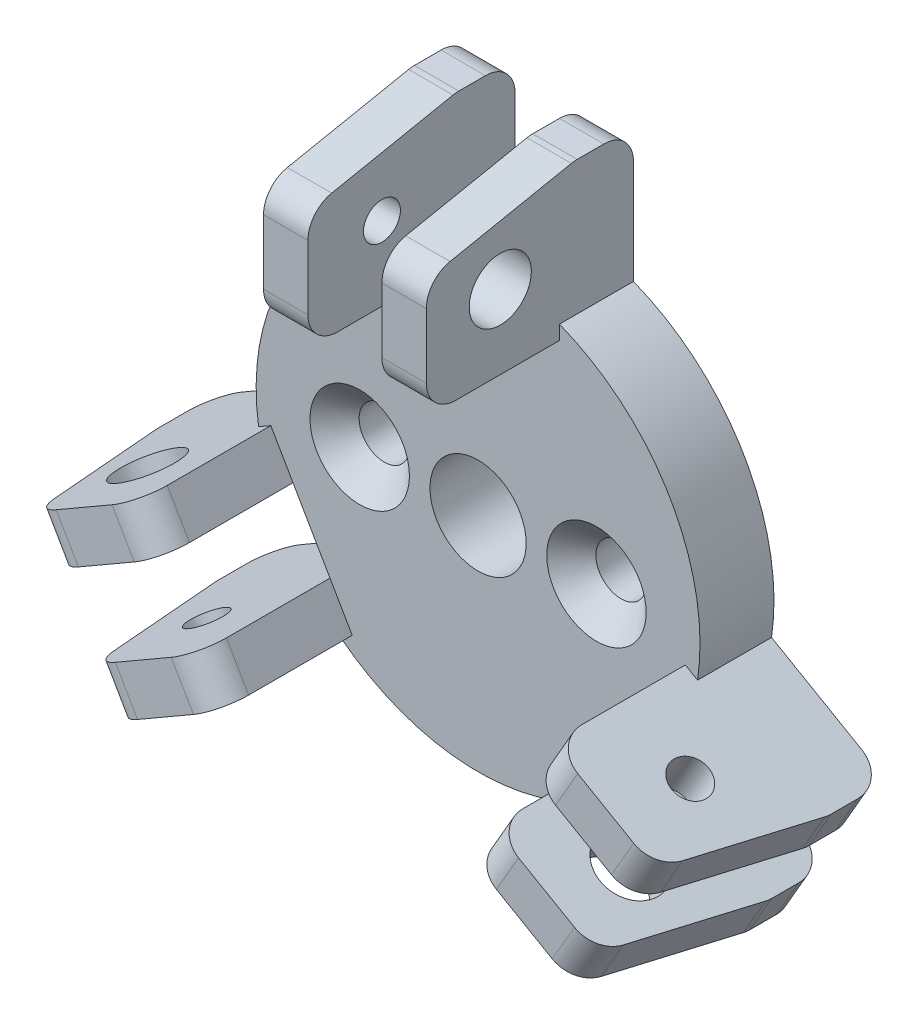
SolidWorks part; units mm, degrees
ref_plane "Front Plane" through (0, 0, 0) normal (0, 0, 1) x (1, 0, 0)
ref_plane "Top Plane" through (0, 0, 0) normal (0, 1, 0) x (1, 0, 0)
ref_plane "Right Plane" through (0, 0, 0) normal (1, 0, 0) x (0, 0, -1)
sketch "Sketch1" plane through (0, 0, 0) normal (0, 0, 1) x (1, 0, 0)
  circle A0 centre (0, 0) radius 15
  dimension "D1" = 30
extrude "Extrude1" add sketch "Sketch1" along normal blind 5
hole_wizard "M6.5 (6.5) Diameter Hole1" positions "Sketch5" profile "Sketch4" hole size "M6.5" standard "Ansi Metric"
sketch "Sketch5" plane through (0, 0, 5) normal (0, 0, 1) x (1, 0, 0)
  point P0 (0, 0)
sketch "Sketch4" plane through (0, 0, 5) normal (1, 0, 0) x (0, -1, 0)
  line L0 (0, 0) -> (0, 5)
  line L1 (0, 5) -> (3.25, 5)
  line L2 (3.25, 5) -> (3.25, 0)
  line L5 (3.25, 0) -> (0, 0)
  line L11 (0, -6.35) -> (0, 107.95) construction
  dimension "Thru Hole Dia." = 6.5
  dimension "Thru Hole Depth" = 5
sketch "Sketch2" plane through (0, 0, 0) normal (1, 0, 0) x (0, 0, -1)
  line L0 (0, -15) -> (0, 15) construction
  line L1 (0, 13) -> (-14, 13)
  line L2 (0, 13) -> (0, 23)
  line L3 (0, 23) -> (-4, 23)
  line L4 (-14, 13) -> (-14, 21)
  line L5 (-4, 23) -> (-14, 21)
  dimension "D1" = 13
  dimension "D2" = 10
  dimension "D3" = 14
  dimension "D4" = 8
  dimension "D5" = 10
extrude "Extrude2" add sketch "Sketch2" along normal mid plane 11
fillet "Fillet1" radius 2 4 edges at (0, 23, 0) (0, 23, 4) (0, 21, 14) (0, 13, 14)
sketch "Sketch3" plane through (0, 0, 0) normal (0, 0, -1) x (-1, 0, 0)
  line L0 (0, 0) -> (0, 23) construction
  line L1 (-5.5, 23) -> (5.5, 23) construction
  line L2 (2.5, 23) -> (-2.5, 23)
  line L3 (-2.5, 23) -> (-2.5, 13)
  line L4 (-2.5, 13) -> (2.5, 13)
  line L5 (2.5, 23) -> (2.5, 13)
  line L6 (-5.5, 13) -> (5.5, 13) construction
  point P9 (0, 13)
  dimension "D1" = 5
extrude "Cut-Extrude1" cut sketch "Sketch3" against normal through all
sketch "Sketch417" plane through (-2.5, 18.0602, 7.9888) normal (1, 0, 0) x (0, 0, -1)
  line L0 (7.9888, -5.0602) -> (7.9888, 2.9398) construction
  circle A0 centre (-1.0112, -0.0602) radius 1.25
  dimension "D1" = 2.5
  dimension "D2" = 9
  dimension "D3" = 18
extrude "Tapped Hole" cut sketch "Sketch417" against normal through all and the other way through all
sketch "Sketch517" plane through (-2.5, 18.0602, 7.9888) normal (1, 0, 0) x (0, 0, -1)
  circle A0 centre (-1.0112, -0.0602) radius 2.1
  dimension "D1" = 4.2
extrude "Shoulder Hole" cut sketch "Sketch517" along normal through all
other "SHOULDER SCREW HOLE<1>"
pattern_circular "CirPattern1" count 3 over 360 about axis through (0, 0, 0) along (0, 0, 1) of "Tapped Hole", "Shoulder Hole", "Extrude2", "Cut-Extrude1", "Fillet1"
hole_wizard "CSK for M3 SFHCS1" positions "Sketch519" profile "Sketch518" countersink size "M3" standard "Ansi Metric"
sketch "Sketch519" plane through (0, 0, 5) normal (0, 0, 1) x (1, 0, 0)
  point P0 (8, 0)
  point P1 (-8, 0)
  dimension "D1" = 8
  dimension "D2" = 16
sketch "Sketch518" plane through (8, 0, 5) normal (1, 0, 0) x (0, -1, 0)
  line L0 (0, 0) -> (0, 5)
  line L1 (0, 5) -> (1.7, 5)
  line L2 (1.7, 5) -> (1.7, 1.66)
  line L3 (1.7, 1.66) -> (3.36, 0)
  line L5 (3.36, 0) -> (0, 0)
  line L6 (-1.7, 1.66) -> (-3.36, 0) construction
  line L11 (0, -6.35) -> (0, 107.95) construction
  dimension "Thru Hole Dia." = 3.4
  dimension "Thru Hole Depth" = 5
  dimension "Near C'Sink Dia." = 6.72
  dimension "Near C'Sink Angle" = 90
